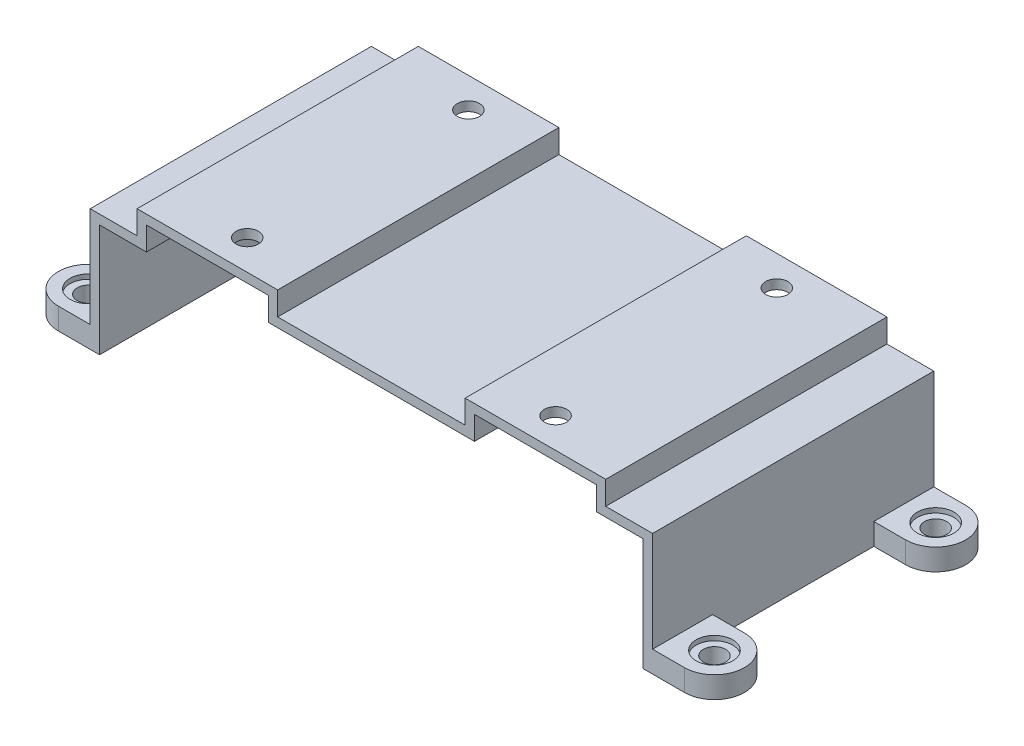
SolidWorks part; units mm, degrees
ref_plane "Front Plane" through (0, 0, 0) normal (0, 0, 1) x (1, 0, 0)
ref_plane "Top Plane" through (0, 0, 0) normal (0, 1, 0) x (1, 0, 0)
ref_plane "Right Plane" through (0, 0, 0) normal (1, 0, 0) x (0, 0, -1)
sketch "Sketch1" plane through (0, 0, 0) normal (0, 0, 1) x (1, 0, 0)
  line L0 (0, 39.6101) -> (0, -35.657) construction
  line L1 (-25.4, 33.02) -> (25.4, 33.02)
  line L2 (-25.4, 33.02) -> (-25.4, 39.37)
  line L3 (25.4, 33.02) -> (25.4, 39.37)
  line L4 (-63.5, 39.37) -> (-25.4, 39.37)
  line L5 (25.4, 39.37) -> (63.5, 39.37)
  line L6 (-63.5, 39.37) -> (-63.5, 33.02)
  line L7 (63.5, 39.37) -> (63.5, 33.02)
  line L8 (-76.2, 33.02) -> (-63.5, 33.02)
  line L9 (63.5, 33.02) -> (76.2, 33.02)
  line L10 (-76.2, 33.02) -> (-76.2, 0)
  line L11 (76.2, 33.02) -> (76.2, 0)
  line L12 (73.66, 30.48) -> (73.66, 0)
  line L13 (60.96, 30.48) -> (73.66, 30.48)
  line L14 (60.96, 36.83) -> (60.96, 30.48)
  line L15 (27.94, 36.83) -> (60.96, 36.83)
  line L16 (27.94, 30.48) -> (27.94, 36.83)
  line L17 (-27.94, 30.48) -> (27.94, 30.48)
  line L18 (-27.94, 30.48) -> (-27.94, 36.83)
  line L19 (-60.96, 36.83) -> (-27.94, 36.83)
  line L20 (-60.96, 36.83) -> (-60.96, 30.48)
  line L21 (-73.66, 30.48) -> (-60.96, 30.48)
  line L22 (-73.66, 30.48) -> (-73.66, 0)
  line L23 (-76.2, 0) -> (-73.66, 0)
  line L24 (76.2, 0) -> (73.66, 0)
  line L27 (-63.5, 33.02) -> (-76.2, 33.02) construction
  line L28 (25.4, 33.02) -> (-25.4, 33.02) construction
  line L29 (-25.4, 39.37) -> (-63.5, 39.37) construction
  line L30 (-60.96, 30.48) -> (-73.66, 30.48) construction
  line L31 (27.94, 30.48) -> (-27.94, 30.48) construction
  line L32 (-27.94, 36.83) -> (-60.96, 36.83) construction
  point P6 (0, 33.02)
  dimension "D1" = 76.2
  dimension "D2" = 25.4
  dimension "D3" = 12.7
  dimension "D6" = 2.54
extrude "Extrude1" add sketch "Sketch1" along normal blind 76.2
sketch "Sketch2" plane through (0, 0, 0) normal (0, -1, 0) x (1, 0, 0)
  line L0 (-76.2, 76.2) -> (-76.2, 0) construction
  line L1 (-76.2, 76.2) -> (-84.836, 76.2)
  line L2 (-76.2, 76.2) -> (-76.2, 59.944)
  line L3 (-76.2, 59.944) -> (-84.836, 59.944)
  line L4 (-25.4, 76.2) -> (-63.5, 76.2) construction
  line L5 (-76.2, 76.2) -> (-76.2, 0) construction
  arc A0 (-84.836, 59.944) -> (-84.836, 76.2) centre (-84.836, 68.072) cw
  dimension "D2" = 8.636
  dimension "D1" = 8.128
extrude "Extrude2" add sketch "Sketch2" against normal blind 5.842
sketch "Sketch3" plane through (0, 5.842, 0) normal (0, 1, 0) x (1, 0, 0)
  circle A0 centre (-84.836, -68.072) radius 4.953
  arc A1 (-84.836, -59.944) -> (-84.836, -76.2) centre (-84.836, -68.072) ccw construction
  dimension "D1" = 9.906
extrude "Extrude3" cut sketch "Sketch3" against normal blind 1.27
hole_wizard "B (0.238) Diameter Hole1" positions "3DSketch1" profile "Sketch6" hole size "B" standard "Ansi Inch"
sketch3d "3DSketch1"
  line L0 (-84.836, 4.572, 68.072) -> (-84.836, 5.842, 68.072) construction
  point P0 (-84.836, 4.572, 68.072)
sketch "Sketch6" plane through (-84.836, 4.572, 68.072) normal (1, 0, 0) x (0, 0, 1)
  line L0 (0, 0) -> (0, 4.5721)
  line L1 (0, 4.5721) -> (3.0226, 4.5721)
  line L2 (3.0226, 4.5721) -> (3.0226, 0)
  line L5 (3.0226, 0) -> (0, 0)
  line L11 (0, -6.35) -> (0, 107.95) construction
  dimension "Thru Hole Dia." = 6.0452
  dimension "Thru Hole Depth" = 4.5721
mirror "Mirror1" about plane through (0, 0, 0) normal (1, 0, 0) of "B (0.238) Diameter Hole1", "Extrude2", "Extrude3"
ref_plane "Plane2" through (0, 0, 38.1) normal (0, 0, 1) x (1, 0, 0)
mirror "Mirror2" about plane through (0, 0, 38.1) normal (0, 0, 1) of "B (0.238) Diameter Hole1", "Extrude2", "Extrude3", "Mirror1"
sketch "Sketch7" plane through (0, 39.37, 0) normal (0, 1, 0) x (1, 0, 0)
  line L0 (-84.836, -8.128) -> (41.783, -8.128) construction
  line L1 (-84.836, -68.072) -> (41.783, -68.072) construction
  line L2 (0, 0) -> (0, 20.7384) construction
  circle A0 centre (-41.783, -8.128) radius 3.0226
  circle A1 centre (-41.783, -68.072) radius 3.0226
  circle A2 centre (41.783, -8.128) radius 3.0226
  circle A3 centre (41.783, -68.072) radius 3.0226
  circle A5 centre (-84.836, -8.128) radius 3.0226 construction
  dimension "D1" = 83.566
extrude "Extrude4" cut sketch "Sketch7" against normal through all
